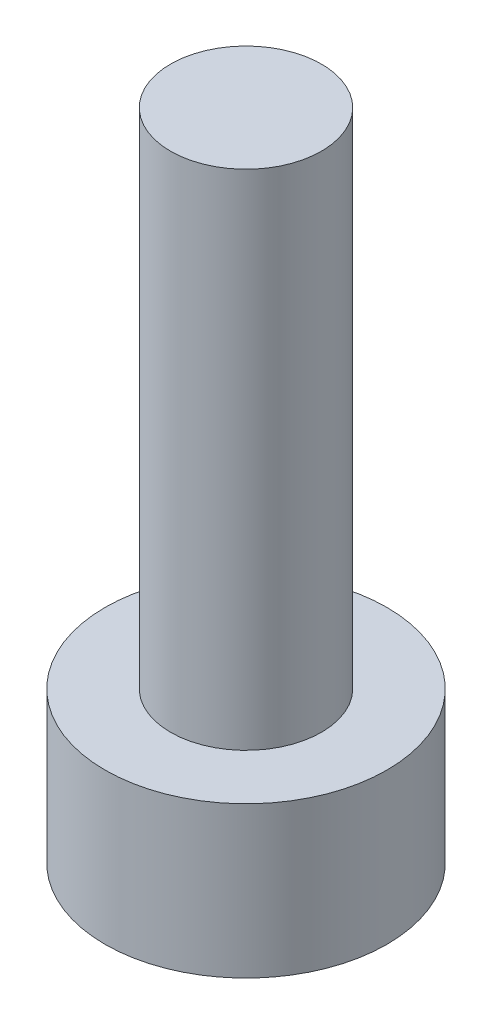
SolidWorks part; units mm, degrees
ref_plane "前视基准面" through (0, 0, 0) normal (0, 0, 1) x (1, 0, 0)
ref_plane "上视基准面" through (0, 0, 0) normal (0, 1, 0) x (1, 0, 0)
ref_plane "右视基准面" through (0, 0, 0) normal (1, 0, 0) x (0, 0, -1)
other "Configuration Table"
sketch "草图1" plane through (0, 0, 0) normal (0, 1, 0) x (1, 0, 0)
  circle A0 centre (0, 0) radius 2.8
  dimension "D1" = 5.6
extrude "凸台-拉伸1" add sketch "草图1" along normal blind 3
sketch "草图2" plane through (0, 3, 0) normal (0, 1, 0) x (1, 0, 0)
  circle A0 centre (0, 0) radius 1.5
  dimension "D1" = 3
extrude "凸台-拉伸2" add sketch "草图2" along normal blind 10
sketch "草图3" plane through (0, 0, 0) normal (0, -1, 0) x (1, 0, 0)
  line L1 (1.0846, -0.9524) -> (1.3671, 0.4631)
  line L2 (1.3671, 0.4631) -> (0.2825, 1.4155)
  line L3 (0.2825, 1.4155) -> (-1.0846, 0.9524)
  line L4 (-1.0846, 0.9524) -> (-1.3671, -0.4631)
  line L5 (-1.3671, -0.4631) -> (-0.2825, -1.4155)
  line L6 (-0.2825, -1.4155) -> (1.0846, -0.9524)
  circle A0 centre (0, 0) radius 1.25 construction
  dimension "D1" = 2.5
extrude "切除-拉伸1" cut sketch "草图3" against normal blind 1.5
